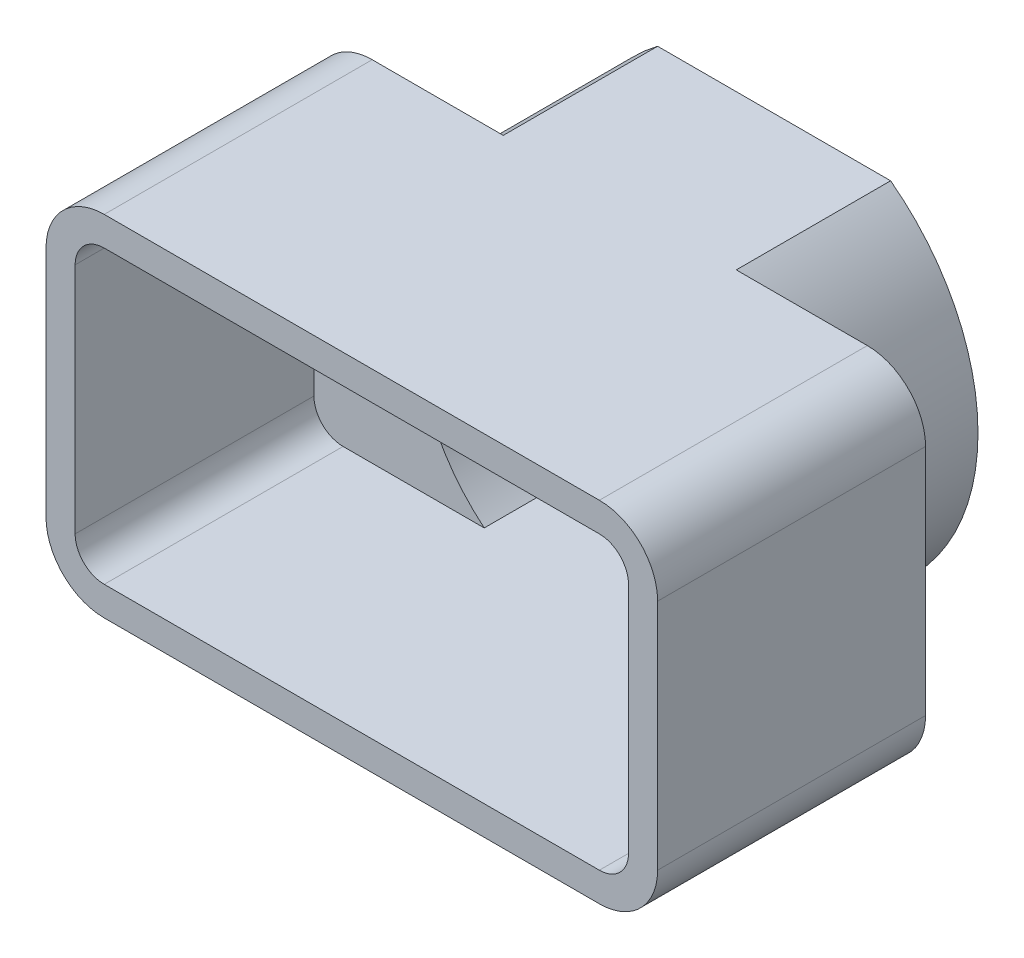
SolidWorks part; units mm, degrees
ref_plane "Plan de face" through (0, 0, 0) normal (0, 0, 1) x (1, 0, 0)
ref_plane "Plan de dessus" through (0, 0, 0) normal (0, 1, 0) x (1, 0, 0)
ref_plane "Plan de droite" through (0, 0, 0) normal (1, 0, 0) x (0, 0, -1)
sketch "Esquisse1" plane through (0, 0, 0) normal (0, 0, 1) x (1, 0, 0)
  line L0 (9.8347, 0) -> (-8.3467, 0) construction
  line L1 (4, 6) -> (-4, 6)
  line L2 (4, 6) -> (4, -6) construction
  line L3 (4, -6) -> (-4, -6)
  line L4 (-4, 6) -> (-4, -6) construction
  line L5 (7, 0) -> (-7, 0) construction
  line L6 (3.6533, 5) -> (-3.6533, 5)
  line L7 (3.6533, -5) -> (-3.6533, -5)
  arc A0 (-4, 6) -> (-4, -6) centre (0.5, 0) ccw
  arc A1 (4, 6) -> (4, -6) centre (-0.5, 0) cw
  arc A2 (-3.6533, 5) -> (-3.6533, -5) centre (0.5, 0) ccw
  arc A3 (3.6533, 5) -> (3.6533, -5) centre (-0.5, 0) cw
  dimension "D3" = 4
  dimension "D5" = 7.5
  dimension "D6" = 7.5
  dimension "D4" = 12
  dimension "D1" = 8
  dimension "D2" = 6
  dimension "D7" = 14
  dimension "D8" = 1
extrude "Boss.-Extru.1" add sketch "Esquisse1" along normal blind 5.3
sketch "Esquisse2" plane through (0, 0, 5.3) normal (0, 0, 1) x (1, 0, 0)
  line L0 (-3.6533, 5) -> (3.6533, 5)
  line L1 (-8.5, -6) -> (8.5, -6)
  line L2 (-10.5, -4) -> (-10.5, 4)
  line L3 (-8.5, 6) -> (8.5, 6)
  line L4 (10.5, -4) -> (10.5, 4)
  line L5 (-10.5, -6) -> (10.5, 6) construction
  line L6 (-10.5, 6) -> (10.5, -6) construction
  line L7 (-3.6533, -5) -> (3.6533, -5)
  arc A0 (-10.5, 4) -> (-8.5, 6) centre (-8.5, 4) cw
  arc A1 (8.5, -6) -> (10.5, -4) centre (8.5, -4) ccw
  arc A2 (8.5, 6) -> (10.5, 4) centre (8.5, 4) cw
  arc A3 (-8.5, -6) -> (-10.5, -4) centre (-8.5, -4) cw
  arc A5 (3.6533, 5) -> (3.6533, -5) centre (-0.5, 0) cw
  arc A6 (-3.6533, 5) -> (-3.6533, -5) centre (0.5, 0) ccw
  point P0 (0, 0)
  dimension "D3" = 2
  dimension "D4" = 2
  dimension "D1" = 12
  dimension "D2" = 21
extrude "Boss.-Extru.2" add sketch "Esquisse2" along normal blind 9.2
sketch "Esquisse3" plane through (0, 0, 14.5) normal (0, 0, 1) x (1, 0, 0)
  line L1 (-8.5, -5) -> (8.5, -5)
  line L2 (-9.5, -4) -> (-9.5, 4)
  line L3 (-8.5, 5) -> (8.5, 5)
  line L4 (9.5, -4) -> (9.5, 4)
  line L5 (-9.5, -5) -> (9.5, 5) construction
  line L6 (-9.5, 5) -> (9.5, -5) construction
  arc A0 (8.5, 5) -> (9.5, 4) centre (8.5, 4) cw
  arc A1 (8.5, -5) -> (9.5, -4) centre (8.5, -4) ccw
  arc A2 (-8.5, -5) -> (-9.5, -4) centre (-8.5, -4) cw
  arc A3 (-9.5, 4) -> (-8.5, 5) centre (-8.5, 4) cw
  point P0 (0, 0)
  dimension "D3" = 1
  dimension "D1" = 10
  dimension "D2" = 19
extrude "Enlèv. mat.-Extru.1" cut sketch "Esquisse3" against normal blind 8.2
sketch "Esquisse6" plane through (0, 0, 0) normal (0, 0, -1) x (-1, 0, 0)
  line L0 (-4, 6) -> (4, 6)
  line L1 (-4, -6) -> (4, -6)
  arc A0 (-4, 6) -> (-4, -6) centre (0.5, 0) ccw
  arc A1 (4, 6) -> (4, -6) centre (-0.5, 0) cw
  circle A2 centre (0, 0) radius 1
extrude "Boss.-Extru.3" add sketch "Esquisse6" against normal blind 1
